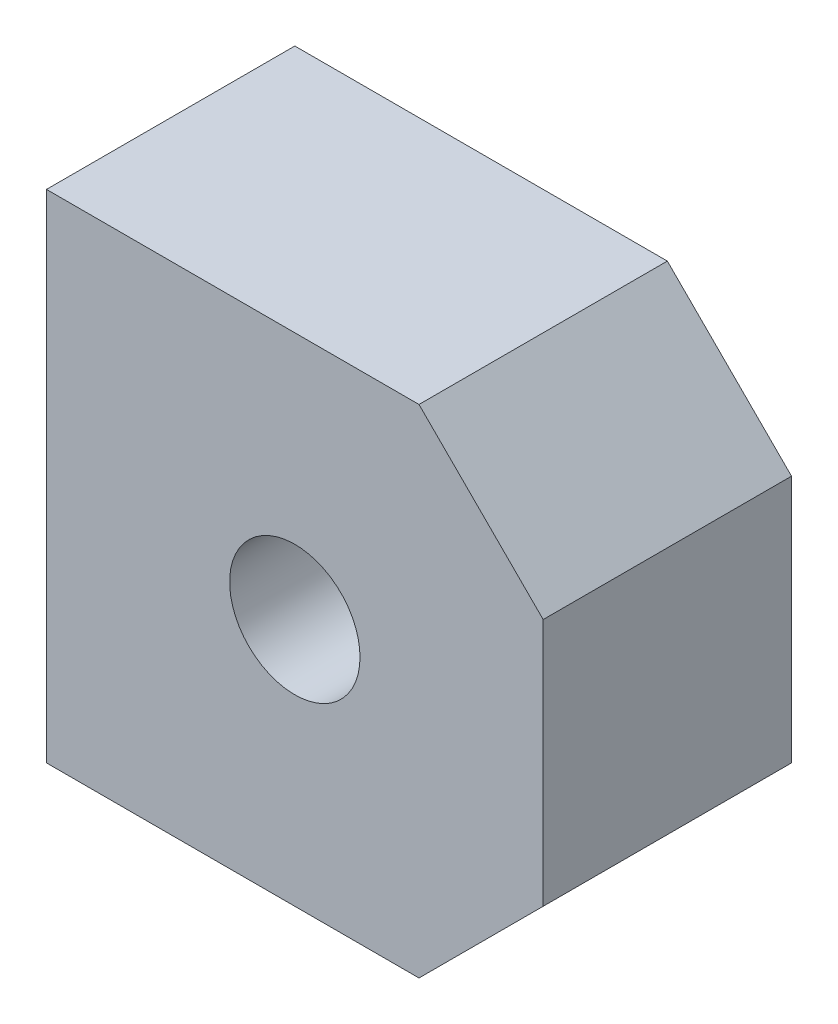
SolidWorks part; units mm, degrees
ref_plane "Plan de face" through (0, 0, 0) normal (0, 0, 1) x (1, 0, 0)
ref_plane "Plan de dessus" through (0, 0, 0) normal (0, 1, 0) x (1, 0, 0)
ref_plane "Plan de droite" through (0, 0, 0) normal (1, 0, 0) x (0, 0, -1)
sketch "Esquisse1" plane through (0, 0, 0) normal (0, 0, 1) x (1, 0, 0)
  line L1 (0, 0) -> (40, 0)
  line L2 (0, 0) -> (0, 40)
  line L3 (0, 40) -> (40, 40)
  line L4 (40, 0) -> (40, 40)
  dimension "D1" = 40
  dimension "D2" = 40
extrude "Extrusion1" add sketch "Esquisse1" along normal blind 20
chamfer "Chanfrein1" distance 10 angle 45 2 edges at (40, 40, 10) (40, 0, 10)
hole_wizard "Trou taraudé M12x1.51" positions "Esquisse3" profile "Esquisse2" tap size "M12x1.5" standard "ISO"
sketch "Esquisse3" plane through (0, 0, 20) normal (0, 0, 1) x (1, 0, 0)
  line L0 (40, 10) -> (40, 30) construction
  line L1 (30, 40) -> (0, 40) construction
  point P0 (20, 20)
  dimension "D1" = 20
  dimension "D2" = 20
sketch "Esquisse2" plane through (20, 20, 20) normal (1, 0, 0) x (0, -1, 0)
  line L0 (0, 0) -> (0, 31.6545)
  line L1 (0, 31.6545) -> (5.25, 28.5)
  line L2 (5.25, 28.5) -> (5.25, 0)
  line L5 (5.25, 0) -> (0, 0)
  line L10 (0, 31.6545) -> (-5.25, 28.5) construction
  line L11 (0, -6.35) -> (0, 107.95) construction
  dimension "Diamètre du trou pour taraudage" = 10.5
  dimension "Profondeur du trou pour taraudage" = 28.5
  dimension "Angle de pointe" = 118
